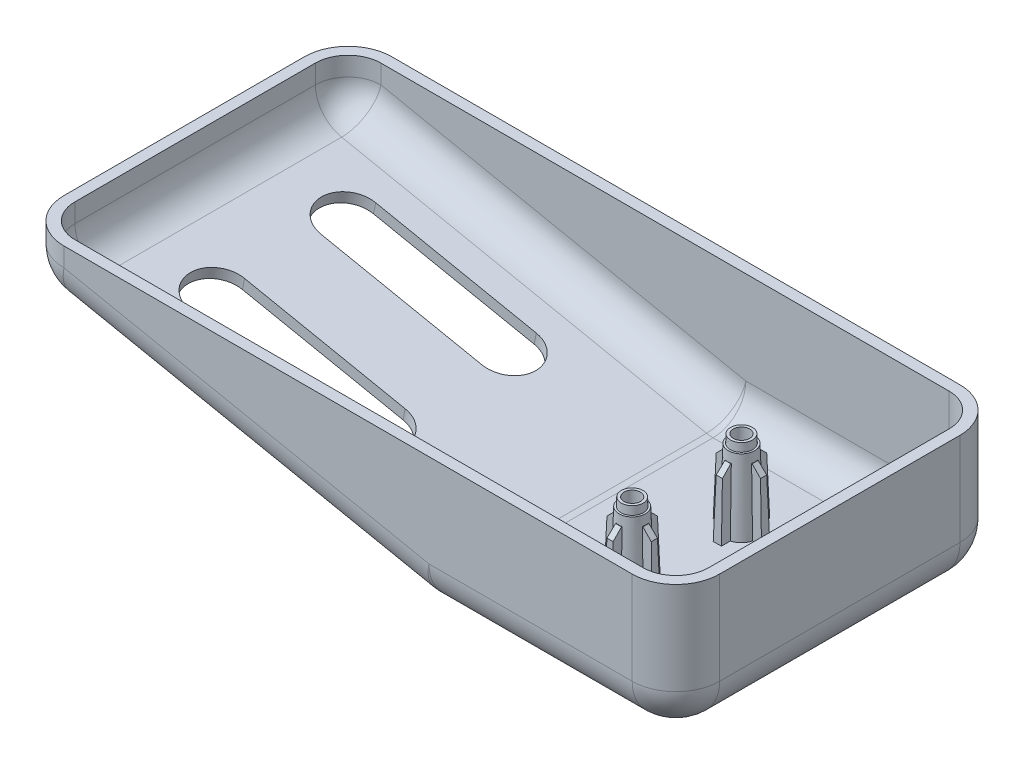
SolidWorks part; units mm, degrees
ref_plane "Front Plane" through (0, 0, 0) normal (0, 0, 1) x (1, 0, 0)
ref_plane "Top Plane" through (0, 0, 0) normal (0, 1, 0) x (1, 0, 0)
ref_plane "Right Plane" through (0, 0, 0) normal (1, 0, 0) x (0, 0, -1)
sketch "Sketch1" plane through (0, 0, 0) normal (0, 0, 1) x (1, 0, 0)
  line L0 (-74, 25) -> (46, 25)
  line L1 (46, 25) -> (46, 0)
  line L2 (46, 0) -> (0, 0)
  line L3 (0, 0) -> (-74, 15)
  line L4 (-74, 15) -> (-74, 25)
  dimension "D1" = 46
  dimension "D2" = 25
  dimension "D3" = 10
  dimension "D4" = 120
extrude "Boss-Extrude1" add sketch "Sketch1" along normal mid plane 60
fillet "Fillet1" radius 8 11 edges at (0, 0, 0) (23, 0, 30) (-37, 7.5, 30) (23, 0, -30) (-37, 7.5, -30) (-74, 15, 0) (46, 0, 0) (46, 12.5, -30) (-74, 20, 30) (-74, 20, -30) (46, 12.5, 30)
shell "Shell1" thickness 2
sketch "Sketch5" plane through (19.934, -2, 0) normal (-0.1987, -0.9801, 0) x (-0.9801, 0.1987, 0)
  line L0 (47.4256, 12) -> (77.4256, 12) construction
  line L1 (47.4256, 17) -> (77.4256, 17)
  line L2 (47.4256, 7) -> (77.4256, 7)
  line L3 (47.4256, -12) -> (77.4256, -12) construction
  line L4 (47.4256, -7) -> (77.4256, -7)
  line L5 (47.4256, -17) -> (77.4256, -17)
  line L6 (-12.342, -30) -> (89.585, -30) construction
  line L8 (97.4256, -22) -> (97.4256, 22) construction
  arc A0 (47.4256, 17) -> (47.4256, 7) centre (47.4256, 12) ccw
  arc A1 (77.4256, 7) -> (77.4256, 17) centre (77.4256, 12) ccw
  arc A2 (47.4256, -7) -> (47.4256, -17) centre (47.4256, -12) ccw
  arc A3 (77.4256, -17) -> (77.4256, -7) centre (77.4256, -12) ccw
  point P2 (62.4256, 12)
  point P8 (62.4256, -12)
  dimension "D5" = 20
  dimension "D1" = 10
  dimension "D2" = 30
  dimension "D3" = 18
  dimension "D4" = 24
extrude "Cut-Extrude1" cut sketch "Sketch5" along normal up to next
sketch3d "3DSketch1"
  point P0 (18, 2, -10)
  dimension "D1" = 28
  dimension "D2" = 20
other "Mounting Boss1" parameters "BossHeight"=14, "BossDiam"=4.8, "StepHeight"=1.5, "StepDia"=4, "HoleDiam"=3, "CBoreDiam"=4, "CBoreDepth"=2, "D8"=0, "D9"=0, "D10"=0, "Clearance"=0.254, "FinLength"=4, "FinWidth"=1.5, "FinHeight"=12, "ChamferDist"=1.5, "BossDraft"=2, "HoleDraft"=1, "StepDraft"=0, "D19"=0, "FinDraft"=1, "ChamferAngle"=45
mirror "Mirror1" about plane through (0, 0, 0) normal (0, 0, 1) of "Mounting Boss1"
